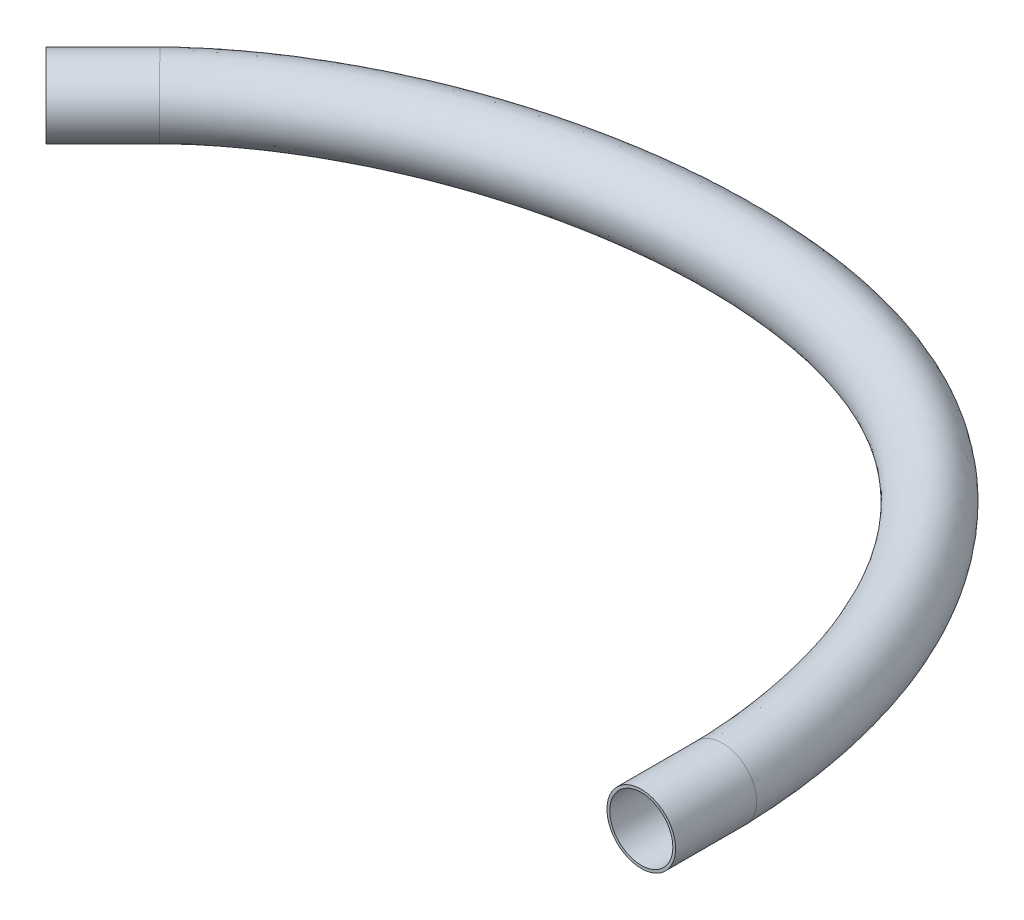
SolidWorks part; units mm, degrees
ref_plane "前视基准面" through (0, 0, 0) normal (0, 0, 1) x (1, 0, 0)
ref_plane "上视基准面" through (0, 0, 0) normal (0, 1, 0) x (1, 0, 0)
ref_plane "右视基准面" through (0, 0, 0) normal (1, 0, 0) x (0, 0, -1)
sketch "草图1" plane through (0, 0, 0) normal (0, 0, 1) x (1, 0, 0)
  circle A0 centre (0, 0) radius 21.75
  circle A1 centre (0, 0) radius 20
  dimension "D1" = 43.5
  dimension "D2" = 40
sketch "草图2" plane through (0, 0, 0) normal (0, 1, 0) x (1, 0, 0)
  line L0 (0, 0) -> (0, 51)
  line L1 (-555, 250) -> (-591.0624, 213.9376)
  spline S0 degree 3 poles (0, 51) (-4.0407, 174.0347) (-141.0776, 407.7501) (-462.1669, 339.2936) (-555, 250) knots 0 0 0 0 0.43826 1 1 1 1
  point P6 (-624.5624, 234.1676)
  point P7 (-588.5, 270.23)
  dimension "D1" = 51
  dimension "D2" = 51
  dimension "D3" = 45
  dimension "D4" = 555
  dimension "D5" = 250
sweep "扫描1" add profiles "草图1" path "草图2"
